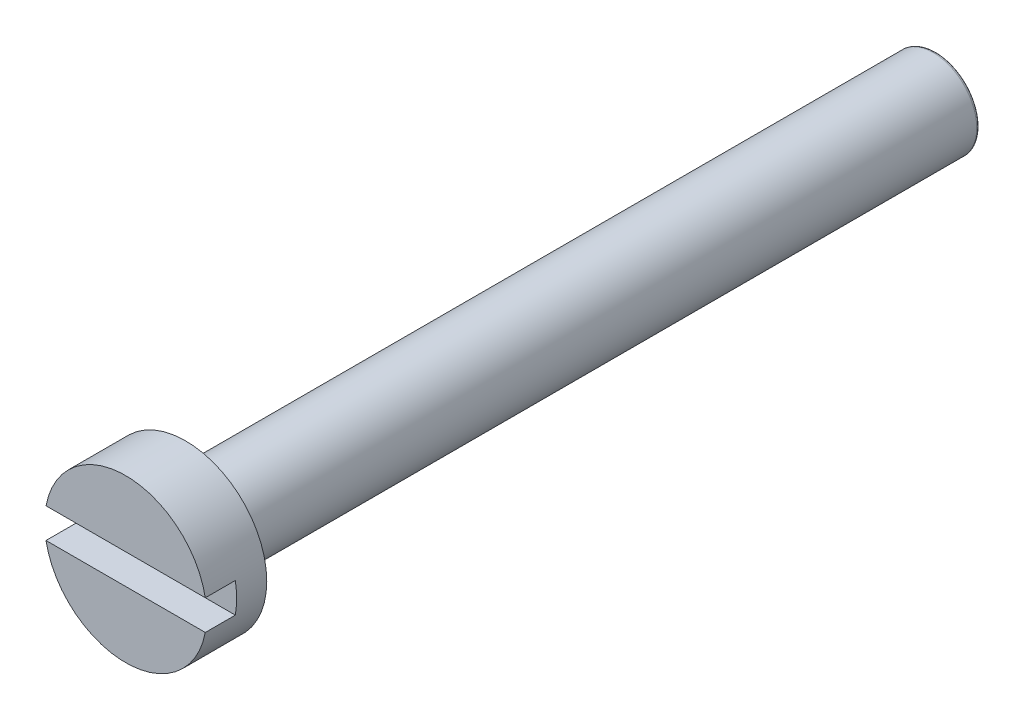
SolidWorks part; units mm, degrees
ref_plane "Plan de face" through (0, 0, 0) normal (0, 0, 1) x (1, 0, 0)
ref_plane "Plan de dessus" through (0, 0, 0) normal (0, 1, 0) x (1, 0, 0)
ref_plane "Plan de droite" through (0, 0, 0) normal (1, 0, 0) x (0, 0, -1)
sketch "Esquisse1" plane through (0, 0, 0) normal (0, 0, 1) x (1, 0, 0)
  circle A0 centre (0, 0) radius 2.7
extrude "Extrusion1" add sketch "Esquisse1" along normal blind 2
sketch "Esquisse2" plane through (0, 0, 2) normal (0, 0, 1) x (1, 0, 0)
  line L1 (-10, 0.5) -> (10, 0.5) construction
  line L2 (-10, -0.5) -> (10, -0.5) construction
  line L3 (-10, 0.5) -> (10, 0.5)
  line L4 (-10, 0.5) -> (-10, -0.5)
  line L5 (-10, -0.5) -> (10, -0.5)
  line L6 (10, 0.5) -> (10, -0.5)
extrude "Enlèv. mat.-Extru.1" cut sketch "Esquisse2" against normal blind 1
sketch "Esquisse3" plane through (0, 0, 0) normal (0, 0, -1) x (-1, 0, 0)
  circle A0 centre (0, 0) radius 1.45
extrude "Extrusion2" add sketch "Esquisse3" along normal blind 25
fillet "Congé1" radius 0.1 1 edges at (-1.45, 0, -25)
